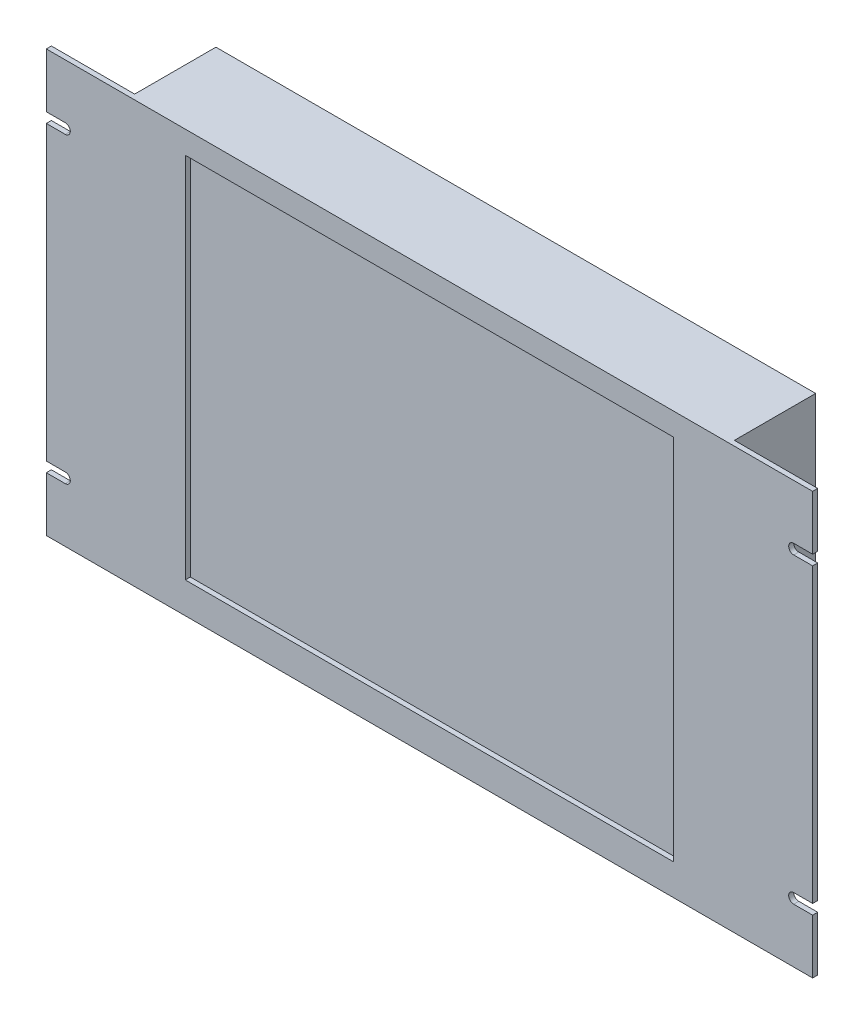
SolidWorks part; units mm, degrees
ref_plane "Front Plane" through (0, 0, 0) normal (0, 0, 1) x (1, 0, 0)
ref_plane "Top Plane" through (0, 0, 0) normal (0, 1, 0) x (1, 0, 0)
ref_plane "Right Plane" through (0, 0, 0) normal (1, 0, 0) x (0, 0, -1)
sketch "Sketch1" plane through (0, 0, 0) normal (0, 0, 1) x (1, 0, 0)
  line L32 (-241.3, 106.299) -> (-229.3874, 106.299)
  line L33 (-241.3, 106.299) -> (-241.3, -77.851)
  line L34 (-241.3, -77.851) -> (-229.3874, -77.851)
  line L35 (-241.3, -84.201) -> (-229.3874, -84.201)
  line L36 (-241.3, -118.491) -> (-241.3, -84.201)
  line L37 (241.3, -118.491) -> (-241.3, -118.491)
  line L38 (241.3, -118.491) -> (241.3, -84.201)
  line L39 (241.3, -84.201) -> (229.3874, -84.201)
  line L40 (241.3, -77.851) -> (229.3874, -77.851)
  line L41 (241.3, 106.299) -> (241.3, -77.851)
  line L42 (241.3, 106.299) -> (229.3874, 106.299)
  line L43 (241.3, 112.649) -> (229.3874, 112.649)
  line L44 (241.3, 112.649) -> (241.3, 146.939)
  line L45 (241.3, 146.939) -> (-241.3, 146.939)
  line L46 (-241.3, 112.649) -> (-241.3, 146.939)
  line L47 (-241.3, 112.649) -> (-229.3874, 112.649)
  line L48 (153.797, -98.933) -> (-153.797, -98.933)
  line L49 (-153.797, -98.933) -> (-153.797, 132.715)
  line L50 (-153.797, 132.715) -> (153.797, 132.715)
  line L51 (153.797, 132.715) -> (153.797, -98.933)
  arc A8 (-229.3874, -84.201) -> (-229.3874, -77.851) centre (-229.3874, -81.026) ccw
  arc A9 (229.3874, -77.851) -> (229.3874, -84.201) centre (229.3874, -81.026) ccw
  arc A10 (229.3874, 112.649) -> (229.3874, 106.299) centre (229.3874, 109.474) ccw
  arc A11 (-229.3874, 106.299) -> (-229.3874, 112.649) centre (-229.3874, 109.474) ccw
  point P28 (0, 0)
  point P29 (0, 0)
extrude "Boss-Extrude1" add sketch "Sketch1" along normal blind 3.175
sketch "Sketch2" plane through (0, 0, 0) normal (0, 0, -1) x (-1, 0, 0)
  line L0 (241.3, 177.165) -> (241.3, 143.256) construction
  line L3 (188.849, -118.491) -> (188.849, 146.939)
  line L4 (-188.849, -118.491) -> (-188.849, 146.939)
  line L5 (-188.849, -118.491) -> (188.849, -118.491)
  line L6 (-188.849, 146.939) -> (188.849, 146.939)
  line L7 (-153.797, -98.933) -> (153.797, -98.933) construction
  line L9 (-241.3, 146.939) -> (241.3, 146.939) construction
  line L10 (241.3, -118.491) -> (-241.3, -118.491) construction
  point P12 (0, 146.939)
  dimension "D1" = 377.698
extrude "Boss-Extrude2" add sketch "Sketch2" along normal blind 51.181
sketch "Sketch4" plane through (0, 0, -51.181) normal (0, 0, -1) x (-1, 0, 0)
  line L9 (106.7722, 119.1082) -> (106.7722, 131.8082)
  line L10 (104.2322, 131.8082) -> (104.2322, 119.1082)
  line L11 (106.7722, 131.8082) -> (104.2322, 131.8082)
  line L12 (106.7722, 119.1082) -> (104.2322, 119.1082)
  line L13 (113.1222, 119.1082) -> (113.1222, 131.8082)
  line L14 (110.5822, 131.8082) -> (110.5822, 119.1082)
  line L15 (113.1222, 131.8082) -> (110.5822, 131.8082)
  line L16 (113.1222, 119.1082) -> (110.5822, 119.1082)
  line L17 (119.4722, 119.1082) -> (119.4722, 131.8082)
  line L18 (116.9322, 131.8082) -> (116.9322, 119.1082)
  line L19 (119.4722, 131.8082) -> (116.9322, 131.8082)
  line L20 (119.4722, 119.1082) -> (116.9322, 119.1082)
  line L21 (125.8222, 119.1082) -> (125.8222, 131.8082)
  line L22 (123.2822, 131.8082) -> (123.2822, 119.1082)
  line L23 (125.8222, 131.8082) -> (123.2822, 131.8082)
  line L24 (125.8222, 119.1082) -> (123.2822, 119.1082)
  line L25 (132.1722, 119.1082) -> (132.1722, 131.8082)
  line L26 (129.6322, 131.8082) -> (129.6322, 119.1082)
  line L27 (132.1722, 131.8082) -> (129.6322, 131.8082)
  line L28 (132.1722, 119.1082) -> (129.6322, 119.1082)
  line L29 (138.5222, 119.1082) -> (138.5222, 131.8082)
  line L30 (135.9822, 131.8082) -> (135.9822, 119.1082)
  line L31 (138.5222, 131.8082) -> (135.9822, 131.8082)
  line L32 (138.5222, 119.1082) -> (135.9822, 119.1082)
  line L33 (144.8722, 119.1082) -> (144.8722, 131.8082)
  line L34 (142.3322, 131.8082) -> (142.3322, 119.1082)
  line L35 (144.8722, 131.8082) -> (142.3322, 131.8082)
  line L36 (144.8722, 119.1082) -> (142.3322, 119.1082)
  line L37 (151.2222, 119.1082) -> (151.2222, 131.8082)
  line L38 (148.6822, 131.8082) -> (148.6822, 119.1082)
  line L39 (151.2222, 131.8082) -> (148.6822, 131.8082)
  line L40 (151.2222, 119.1082) -> (148.6822, 119.1082)
  line L41 (157.5722, 119.1082) -> (157.5722, 131.8082)
  line L42 (155.0322, 131.8082) -> (155.0322, 119.1082)
  line L43 (157.5722, 131.8082) -> (155.0322, 131.8082)
  line L44 (157.5722, 119.1082) -> (155.0322, 119.1082)
  line L45 (163.9222, 119.1082) -> (163.9222, 131.8082)
  line L46 (161.3822, 131.8082) -> (161.3822, 119.1082)
  line L47 (163.9222, 131.8082) -> (161.3822, 131.8082)
  line L48 (163.9222, 119.1082) -> (161.3822, 119.1082)
  line L49 (70.222, 20.653) -> (70.222, 33.353)
  line L50 (67.682, 33.353) -> (67.682, 20.653)
  line L51 (70.222, 33.353) -> (67.682, 33.353)
  line L52 (70.222, 20.653) -> (67.682, 20.653)
  line L53 (76.572, 20.653) -> (76.572, 33.353)
  line L54 (74.032, 33.353) -> (74.032, 20.653)
  line L55 (76.572, 33.353) -> (74.032, 33.353)
  line L56 (76.572, 20.653) -> (74.032, 20.653)
  line L57 (70.222, 1.603) -> (70.222, 14.303)
  line L58 (67.682, 14.303) -> (67.682, 1.603)
  line L59 (70.222, 14.303) -> (67.682, 14.303)
  line L60 (70.222, 1.603) -> (67.682, 1.603)
  line L61 (76.572, 1.603) -> (76.572, 14.303)
  line L62 (74.032, 14.303) -> (74.032, 1.603)
  line L63 (76.572, 14.303) -> (74.032, 14.303)
  line L64 (76.572, 1.603) -> (74.032, 1.603)
  line L65 (82.922, 20.653) -> (82.922, 33.353)
  line L66 (80.382, 33.353) -> (80.382, 20.653)
  line L67 (82.922, 33.353) -> (80.382, 33.353)
  line L68 (82.922, 20.653) -> (80.382, 20.653)
  line L69 (89.272, 20.653) -> (89.272, 33.353)
  line L70 (86.732, 33.353) -> (86.732, 20.653)
  line L71 (89.272, 33.353) -> (86.732, 33.353)
  line L72 (89.272, 20.653) -> (86.732, 20.653)
  line L73 (95.622, 20.653) -> (95.622, 33.353)
  line L74 (93.082, 33.353) -> (93.082, 20.653)
  line L75 (95.622, 33.353) -> (93.082, 33.353)
  line L76 (95.622, 20.653) -> (93.082, 20.653)
  line L77 (101.972, 20.653) -> (101.972, 33.353)
  line L78 (99.432, 33.353) -> (99.432, 20.653)
  line L79 (101.972, 33.353) -> (99.432, 33.353)
  line L80 (101.972, 20.653) -> (99.432, 20.653)
  line L81 (82.922, 1.603) -> (82.922, 14.303)
  line L82 (80.382, 14.303) -> (80.382, 1.603)
  line L83 (82.922, 14.303) -> (80.382, 14.303)
  line L84 (82.922, 1.603) -> (80.382, 1.603)
  line L85 (89.272, 1.603) -> (89.272, 14.303)
  line L86 (86.732, 14.303) -> (86.732, 1.603)
  line L87 (89.272, 14.303) -> (86.732, 14.303)
  line L88 (89.272, 1.603) -> (86.732, 1.603)
  line L89 (95.622, 1.603) -> (95.622, 14.303)
  line L90 (93.082, 14.303) -> (93.082, 1.603)
  line L91 (95.622, 14.303) -> (93.082, 14.303)
  line L92 (95.622, 1.603) -> (93.082, 1.603)
  line L93 (101.972, 1.603) -> (101.972, 14.303)
  line L94 (99.432, 14.303) -> (99.432, 1.603)
  line L95 (101.972, 14.303) -> (99.432, 14.303)
  line L96 (101.972, 1.603) -> (99.432, 1.603)
  line L97 (108.322, 20.653) -> (108.322, 33.353)
  line L98 (105.782, 33.353) -> (105.782, 20.653)
  line L99 (108.322, 33.353) -> (105.782, 33.353)
  line L100 (108.322, 20.653) -> (105.782, 20.653)
  line L101 (114.672, 20.653) -> (114.672, 33.353)
  line L102 (112.132, 33.353) -> (112.132, 20.653)
  line L103 (114.672, 33.353) -> (112.132, 33.353)
  line L104 (114.672, 20.653) -> (112.132, 20.653)
  line L105 (121.022, 20.653) -> (121.022, 33.353)
  line L106 (118.482, 33.353) -> (118.482, 20.653)
  line L107 (121.022, 33.353) -> (118.482, 33.353)
  line L108 (121.022, 20.653) -> (118.482, 20.653)
  line L109 (108.322, 1.603) -> (108.322, 14.303)
  line L110 (105.782, 14.303) -> (105.782, 1.603)
  line L111 (108.322, 14.303) -> (105.782, 14.303)
  line L112 (108.322, 1.603) -> (105.782, 1.603)
  line L113 (114.672, 1.603) -> (114.672, 14.303)
  line L114 (112.132, 14.303) -> (112.132, 1.603)
  line L115 (114.672, 14.303) -> (112.132, 14.303)
  line L116 (114.672, 1.603) -> (112.132, 1.603)
  line L117 (121.022, 1.603) -> (121.022, 14.303)
  line L118 (118.482, 14.303) -> (118.482, 1.603)
  line L119 (121.022, 14.303) -> (118.482, 14.303)
  line L120 (121.022, 1.603) -> (118.482, 1.603)
  line L121 (-105.3114, 119.1082) -> (-105.3114, 131.8082)
  line L122 (-102.7714, 131.8082) -> (-102.7714, 119.1082)
  line L123 (-105.3114, 131.8082) -> (-102.7714, 131.8082)
  line L124 (-105.3114, 119.1082) -> (-102.7714, 119.1082)
  line L125 (-111.6614, 119.1082) -> (-111.6614, 131.8082)
  line L126 (-109.1214, 131.8082) -> (-109.1214, 119.1082)
  line L127 (-111.6614, 131.8082) -> (-109.1214, 131.8082)
  line L128 (-111.6614, 119.1082) -> (-109.1214, 119.1082)
  line L129 (-118.0114, 119.1082) -> (-118.0114, 131.8082)
  line L130 (-115.4714, 131.8082) -> (-115.4714, 119.1082)
  line L131 (-118.0114, 131.8082) -> (-115.4714, 131.8082)
  line L132 (-118.0114, 119.1082) -> (-115.4714, 119.1082)
  line L133 (-105.3114, 100.0582) -> (-105.3114, 112.7582)
  line L134 (-102.7714, 112.7582) -> (-102.7714, 100.0582)
  line L135 (-105.3114, 112.7582) -> (-102.7714, 112.7582)
  line L136 (-105.3114, 100.0582) -> (-102.7714, 100.0582)
  line L137 (-111.6614, 100.0582) -> (-111.6614, 112.7582)
  line L138 (-109.1214, 112.7582) -> (-109.1214, 100.0582)
  line L139 (-111.6614, 112.7582) -> (-109.1214, 112.7582)
  line L140 (-111.6614, 100.0582) -> (-109.1214, 100.0582)
  line L141 (-118.0114, 100.0582) -> (-118.0114, 112.7582)
  line L142 (-115.4714, 112.7582) -> (-115.4714, 100.0582)
  line L143 (-118.0114, 112.7582) -> (-115.4714, 112.7582)
  line L144 (-118.0114, 100.0582) -> (-115.4714, 100.0582)
  line L145 (-124.3614, 119.1082) -> (-124.3614, 131.8082)
  line L146 (-121.8214, 131.8082) -> (-121.8214, 119.1082)
  line L147 (-124.3614, 131.8082) -> (-121.8214, 131.8082)
  line L148 (-124.3614, 119.1082) -> (-121.8214, 119.1082)
  line L149 (-124.3614, 100.0582) -> (-124.3614, 112.7582)
  line L150 (-121.8214, 112.7582) -> (-121.8214, 100.0582)
  line L151 (-124.3614, 112.7582) -> (-121.8214, 112.7582)
  line L152 (-124.3614, 100.0582) -> (-121.8214, 100.0582)
  line L153 (-130.7114, 119.1082) -> (-130.7114, 131.8082)
  line L154 (-128.1714, 131.8082) -> (-128.1714, 119.1082)
  line L155 (-130.7114, 131.8082) -> (-128.1714, 131.8082)
  line L156 (-130.7114, 119.1082) -> (-128.1714, 119.1082)
  line L157 (-130.7114, 100.0582) -> (-130.7114, 112.7582)
  line L158 (-128.1714, 112.7582) -> (-128.1714, 100.0582)
  line L159 (-130.7114, 112.7582) -> (-128.1714, 112.7582)
  line L160 (-130.7114, 100.0582) -> (-128.1714, 100.0582)
  line L161 (-137.0614, 119.1082) -> (-137.0614, 131.8082)
  line L162 (-134.5214, 131.8082) -> (-134.5214, 119.1082)
  line L163 (-137.0614, 131.8082) -> (-134.5214, 131.8082)
  line L164 (-137.0614, 119.1082) -> (-134.5214, 119.1082)
  line L165 (-137.0614, 100.0582) -> (-137.0614, 112.7582)
  line L166 (-134.5214, 112.7582) -> (-134.5214, 100.0582)
  line L167 (-137.0614, 112.7582) -> (-134.5214, 112.7582)
  line L168 (-137.0614, 100.0582) -> (-134.5214, 100.0582)
  line L169 (-143.4114, 119.1082) -> (-143.4114, 131.8082)
  line L170 (-140.8714, 131.8082) -> (-140.8714, 119.1082)
  line L171 (-143.4114, 131.8082) -> (-140.8714, 131.8082)
  line L172 (-143.4114, 119.1082) -> (-140.8714, 119.1082)
  line L173 (-143.4114, 100.0582) -> (-143.4114, 112.7582)
  line L174 (-140.8714, 112.7582) -> (-140.8714, 100.0582)
  line L175 (-143.4114, 112.7582) -> (-140.8714, 112.7582)
  line L176 (-143.4114, 100.0582) -> (-140.8714, 100.0582)
  line L177 (-149.7614, 119.1082) -> (-149.7614, 131.8082)
  line L178 (-147.2214, 131.8082) -> (-147.2214, 119.1082)
  line L179 (-149.7614, 131.8082) -> (-147.2214, 131.8082)
  line L180 (-149.7614, 119.1082) -> (-147.2214, 119.1082)
  line L181 (-149.7614, 100.0582) -> (-149.7614, 112.7582)
  line L182 (-147.2214, 112.7582) -> (-147.2214, 100.0582)
  line L183 (-149.7614, 112.7582) -> (-147.2214, 112.7582)
  line L184 (-149.7614, 100.0582) -> (-147.2214, 100.0582)
  line L185 (-156.1114, 119.1082) -> (-156.1114, 131.8082)
  line L186 (-153.5714, 131.8082) -> (-153.5714, 119.1082)
  line L187 (-156.1114, 131.8082) -> (-153.5714, 131.8082)
  line L188 (-156.1114, 119.1082) -> (-153.5714, 119.1082)
  line L189 (-156.1114, 100.0582) -> (-156.1114, 112.7582)
  line L190 (-153.5714, 112.7582) -> (-153.5714, 100.0582)
  line L191 (-156.1114, 112.7582) -> (-153.5714, 112.7582)
  line L192 (-156.1114, 100.0582) -> (-153.5714, 100.0582)
  line L193 (-162.4614, 119.1082) -> (-162.4614, 131.8082)
  line L194 (-159.9214, 131.8082) -> (-159.9214, 119.1082)
  line L195 (-162.4614, 131.8082) -> (-159.9214, 131.8082)
  line L196 (-162.4614, 119.1082) -> (-159.9214, 119.1082)
  line L197 (-162.4614, 100.0582) -> (-162.4614, 112.7582)
  line L198 (-159.9214, 112.7582) -> (-159.9214, 100.0582)
  line L199 (-162.4614, 112.7582) -> (-159.9214, 112.7582)
  line L200 (-162.4614, 100.0582) -> (-159.9214, 100.0582)
  line L201 (-79.9114, 119.1082) -> (-79.9114, 131.8082)
  line L202 (-77.3714, 131.8082) -> (-77.3714, 119.1082)
  line L203 (-79.9114, 131.8082) -> (-77.3714, 131.8082)
  line L204 (-79.9114, 119.1082) -> (-77.3714, 119.1082)
  line L205 (-86.2614, 119.1082) -> (-86.2614, 131.8082)
  line L206 (-83.7214, 131.8082) -> (-83.7214, 119.1082)
  line L207 (-86.2614, 131.8082) -> (-83.7214, 131.8082)
  line L208 (-86.2614, 119.1082) -> (-83.7214, 119.1082)
  line L209 (-92.6114, 119.1082) -> (-92.6114, 131.8082)
  line L210 (-90.0714, 131.8082) -> (-90.0714, 119.1082)
  line L211 (-92.6114, 131.8082) -> (-90.0714, 131.8082)
  line L212 (-92.6114, 119.1082) -> (-90.0714, 119.1082)
  line L213 (-79.9114, 100.0582) -> (-79.9114, 112.7582)
  line L214 (-77.3714, 112.7582) -> (-77.3714, 100.0582)
  line L215 (-79.9114, 112.7582) -> (-77.3714, 112.7582)
  line L216 (-79.9114, 100.0582) -> (-77.3714, 100.0582)
  line L217 (-86.2614, 100.0582) -> (-86.2614, 112.7582)
  line L218 (-83.7214, 112.7582) -> (-83.7214, 100.0582)
  line L219 (-86.2614, 112.7582) -> (-83.7214, 112.7582)
  line L220 (-86.2614, 100.0582) -> (-83.7214, 100.0582)
  line L221 (-92.6114, 100.0582) -> (-92.6114, 112.7582)
  line L222 (-90.0714, 112.7582) -> (-90.0714, 100.0582)
  line L223 (-92.6114, 112.7582) -> (-90.0714, 112.7582)
  line L224 (-92.6114, 100.0582) -> (-90.0714, 100.0582)
  line L225 (-98.9614, 119.1082) -> (-98.9614, 131.8082)
  line L226 (-96.4214, 131.8082) -> (-96.4214, 119.1082)
  line L227 (-98.9614, 131.8082) -> (-96.4214, 131.8082)
  line L228 (-98.9614, 119.1082) -> (-96.4214, 119.1082)
  line L229 (-98.9614, 100.0582) -> (-98.9614, 112.7582)
  line L230 (-96.4214, 112.7582) -> (-96.4214, 100.0582)
  line L231 (-98.9614, 112.7582) -> (-96.4214, 112.7582)
  line L232 (-98.9614, 100.0582) -> (-96.4214, 100.0582)
  line L233 (81.3722, 119.1082) -> (81.3722, 131.8082)
  line L234 (78.8322, 131.8082) -> (78.8322, 119.1082)
  line L235 (81.3722, 131.8082) -> (78.8322, 131.8082)
  line L236 (81.3722, 119.1082) -> (78.8322, 119.1082)
  line L237 (87.7222, 119.1082) -> (87.7222, 131.8082)
  line L238 (85.1822, 131.8082) -> (85.1822, 119.1082)
  line L239 (87.7222, 131.8082) -> (85.1822, 131.8082)
  line L240 (87.7222, 119.1082) -> (85.1822, 119.1082)
  line L241 (94.0722, 119.1082) -> (94.0722, 131.8082)
  line L242 (91.5322, 131.8082) -> (91.5322, 119.1082)
  line L243 (94.0722, 131.8082) -> (91.5322, 131.8082)
  line L244 (94.0722, 119.1082) -> (91.5322, 119.1082)
  line L245 (100.4222, 119.1082) -> (100.4222, 131.8082)
  line L246 (97.8822, 131.8082) -> (97.8822, 119.1082)
  line L247 (100.4222, 131.8082) -> (97.8822, 131.8082)
  line L248 (100.4222, 119.1082) -> (97.8822, 119.1082)
  line L249 (-54.5114, 119.1082) -> (-54.5114, 131.8082)
  line L250 (-51.9714, 131.8082) -> (-51.9714, 119.1082)
  line L251 (-54.5114, 131.8082) -> (-51.9714, 131.8082)
  line L252 (-54.5114, 119.1082) -> (-51.9714, 119.1082)
  line L253 (-60.8614, 119.1082) -> (-60.8614, 131.8082)
  line L254 (-58.3214, 131.8082) -> (-58.3214, 119.1082)
  line L255 (-60.8614, 131.8082) -> (-58.3214, 131.8082)
  line L256 (-60.8614, 119.1082) -> (-58.3214, 119.1082)
  line L257 (-67.2114, 119.1082) -> (-67.2114, 131.8082)
  line L258 (-64.6714, 131.8082) -> (-64.6714, 119.1082)
  line L259 (-67.2114, 131.8082) -> (-64.6714, 131.8082)
  line L260 (-67.2114, 119.1082) -> (-64.6714, 119.1082)
  line L261 (-73.5614, 119.1082) -> (-73.5614, 131.8082)
  line L262 (-71.0214, 131.8082) -> (-71.0214, 119.1082)
  line L263 (-73.5614, 131.8082) -> (-71.0214, 131.8082)
  line L264 (-73.5614, 119.1082) -> (-71.0214, 119.1082)
  line L265 (-29.1114, 119.1082) -> (-29.1114, 131.8082)
  line L266 (-26.5714, 131.8082) -> (-26.5714, 119.1082)
  line L267 (-29.1114, 131.8082) -> (-26.5714, 131.8082)
  line L268 (-29.1114, 119.1082) -> (-26.5714, 119.1082)
  line L269 (-35.4614, 119.1082) -> (-35.4614, 131.8082)
  line L270 (-32.9214, 131.8082) -> (-32.9214, 119.1082)
  line L271 (-35.4614, 131.8082) -> (-32.9214, 131.8082)
  line L272 (-35.4614, 119.1082) -> (-32.9214, 119.1082)
  line L273 (-41.8114, 119.1082) -> (-41.8114, 131.8082)
  line L274 (-39.2714, 131.8082) -> (-39.2714, 119.1082)
  line L275 (-41.8114, 131.8082) -> (-39.2714, 131.8082)
  line L276 (-41.8114, 119.1082) -> (-39.2714, 119.1082)
  line L277 (-48.1614, 119.1082) -> (-48.1614, 131.8082)
  line L278 (-45.6214, 131.8082) -> (-45.6214, 119.1082)
  line L279 (-48.1614, 131.8082) -> (-45.6214, 131.8082)
  line L280 (-48.1614, 119.1082) -> (-45.6214, 119.1082)
  line L281 (-3.7114, 119.1082) -> (-3.7114, 131.8082)
  line L282 (-1.1714, 131.8082) -> (-1.1714, 119.1082)
  line L283 (-3.7114, 131.8082) -> (-1.1714, 131.8082)
  line L284 (-3.7114, 119.1082) -> (-1.1714, 119.1082)
  line L285 (-10.0614, 119.1082) -> (-10.0614, 131.8082)
  line L286 (-7.5214, 131.8082) -> (-7.5214, 119.1082)
  line L287 (-10.0614, 131.8082) -> (-7.5214, 131.8082)
  line L288 (-10.0614, 119.1082) -> (-7.5214, 119.1082)
  line L289 (-16.4114, 119.1082) -> (-16.4114, 131.8082)
  line L290 (-13.8714, 131.8082) -> (-13.8714, 119.1082)
  line L291 (-16.4114, 131.8082) -> (-13.8714, 131.8082)
  line L292 (-16.4114, 119.1082) -> (-13.8714, 119.1082)
  line L293 (-22.7614, 119.1082) -> (-22.7614, 131.8082)
  line L294 (-20.2214, 131.8082) -> (-20.2214, 119.1082)
  line L295 (-22.7614, 131.8082) -> (-20.2214, 131.8082)
  line L296 (-22.7614, 119.1082) -> (-20.2214, 119.1082)
  line L297 (21.6886, 119.1082) -> (21.6886, 131.8082)
  line L298 (24.2286, 131.8082) -> (24.2286, 119.1082)
  line L299 (21.6886, 131.8082) -> (24.2286, 131.8082)
  line L300 (21.6886, 119.1082) -> (24.2286, 119.1082)
  line L301 (15.3386, 119.1082) -> (15.3386, 131.8082)
  line L302 (17.8786, 131.8082) -> (17.8786, 119.1082)
  line L303 (15.3386, 131.8082) -> (17.8786, 131.8082)
  line L304 (15.3386, 119.1082) -> (17.8786, 119.1082)
  line L305 (8.9886, 119.1082) -> (8.9886, 131.8082)
  line L306 (11.5286, 131.8082) -> (11.5286, 119.1082)
  line L307 (8.9886, 131.8082) -> (11.5286, 131.8082)
  line L308 (8.9886, 119.1082) -> (11.5286, 119.1082)
  line L309 (2.6386, 119.1082) -> (2.6386, 131.8082)
  line L310 (5.1786, 131.8082) -> (5.1786, 119.1082)
  line L311 (2.6386, 131.8082) -> (5.1786, 131.8082)
  line L312 (2.6386, 119.1082) -> (5.1786, 119.1082)
  line L313 (47.0886, 119.1082) -> (47.0886, 131.8082)
  line L314 (49.6286, 131.8082) -> (49.6286, 119.1082)
  line L315 (47.0886, 131.8082) -> (49.6286, 131.8082)
  line L316 (47.0886, 119.1082) -> (49.6286, 119.1082)
  line L317 (40.7386, 119.1082) -> (40.7386, 131.8082)
  line L318 (43.2786, 131.8082) -> (43.2786, 119.1082)
  line L319 (40.7386, 131.8082) -> (43.2786, 131.8082)
  line L320 (40.7386, 119.1082) -> (43.2786, 119.1082)
  line L321 (34.3886, 119.1082) -> (34.3886, 131.8082)
  line L322 (36.9286, 131.8082) -> (36.9286, 119.1082)
  line L323 (34.3886, 131.8082) -> (36.9286, 131.8082)
  line L324 (34.3886, 119.1082) -> (36.9286, 119.1082)
  line L325 (28.0386, 119.1082) -> (28.0386, 131.8082)
  line L326 (30.5786, 131.8082) -> (30.5786, 119.1082)
  line L327 (28.0386, 131.8082) -> (30.5786, 131.8082)
  line L328 (28.0386, 119.1082) -> (30.5786, 119.1082)
  line L329 (72.4886, 119.1082) -> (72.4886, 131.8082)
  line L330 (75.0286, 131.8082) -> (75.0286, 119.1082)
  line L331 (72.4886, 131.8082) -> (75.0286, 131.8082)
  line L332 (72.4886, 119.1082) -> (75.0286, 119.1082)
  line L333 (66.1386, 119.1082) -> (66.1386, 131.8082)
  line L334 (68.6786, 131.8082) -> (68.6786, 119.1082)
  line L335 (66.1386, 131.8082) -> (68.6786, 131.8082)
  line L336 (66.1386, 119.1082) -> (68.6786, 119.1082)
  line L337 (59.7886, 119.1082) -> (59.7886, 131.8082)
  line L338 (62.3286, 131.8082) -> (62.3286, 119.1082)
  line L339 (59.7886, 131.8082) -> (62.3286, 131.8082)
  line L340 (59.7886, 119.1082) -> (62.3286, 119.1082)
  line L341 (53.4386, 119.1082) -> (53.4386, 131.8082)
  line L342 (55.9786, 131.8082) -> (55.9786, 119.1082)
  line L343 (53.4386, 131.8082) -> (55.9786, 131.8082)
  line L344 (53.4386, 119.1082) -> (55.9786, 119.1082)
  line L345 (70.222, -17.447) -> (70.222, -4.747)
  line L346 (67.682, -4.747) -> (67.682, -17.447)
  line L347 (70.222, -4.747) -> (67.682, -4.747)
  line L348 (70.222, -17.447) -> (67.682, -17.447)
  line L349 (76.572, -17.447) -> (76.572, -4.747)
  line L350 (74.032, -4.747) -> (74.032, -17.447)
  line L351 (76.572, -4.747) -> (74.032, -4.747)
  line L352 (76.572, -17.447) -> (74.032, -17.447)
  line L353 (82.922, -17.447) -> (82.922, -4.747)
  line L354 (80.382, -4.747) -> (80.382, -17.447)
  line L355 (82.922, -4.747) -> (80.382, -4.747)
  line L356 (82.922, -17.447) -> (80.382, -17.447)
  line L357 (89.272, -17.447) -> (89.272, -4.747)
  line L358 (86.732, -4.747) -> (86.732, -17.447)
  line L359 (89.272, -4.747) -> (86.732, -4.747)
  line L360 (89.272, -17.447) -> (86.732, -17.447)
  line L361 (95.622, -17.447) -> (95.622, -4.747)
  line L362 (93.082, -4.747) -> (93.082, -17.447)
  line L363 (95.622, -4.747) -> (93.082, -4.747)
  line L364 (95.622, -17.447) -> (93.082, -17.447)
  line L365 (101.972, -17.447) -> (101.972, -4.747)
  line L366 (99.432, -4.747) -> (99.432, -17.447)
  line L367 (101.972, -4.747) -> (99.432, -4.747)
  line L368 (101.972, -17.447) -> (99.432, -17.447)
  line L369 (108.322, -17.447) -> (108.322, -4.747)
  line L370 (105.782, -4.747) -> (105.782, -17.447)
  line L371 (108.322, -4.747) -> (105.782, -4.747)
  line L372 (108.322, -17.447) -> (105.782, -17.447)
  line L373 (114.672, -17.447) -> (114.672, -4.747)
  line L374 (112.132, -4.747) -> (112.132, -17.447)
  line L375 (114.672, -4.747) -> (112.132, -4.747)
  line L376 (114.672, -17.447) -> (112.132, -17.447)
  line L377 (121.022, -17.447) -> (121.022, -4.747)
  line L378 (118.482, -4.747) -> (118.482, -17.447)
  line L379 (121.022, -4.747) -> (118.482, -4.747)
  line L380 (121.022, -17.447) -> (118.482, -17.447)
  line L381 (-105.3114, 81.0082) -> (-105.3114, 93.7082)
  line L382 (-102.7714, 93.7082) -> (-102.7714, 81.0082)
  line L383 (-105.3114, 93.7082) -> (-102.7714, 93.7082)
  line L384 (-105.3114, 81.0082) -> (-102.7714, 81.0082)
  line L385 (-111.6614, 81.0082) -> (-111.6614, 93.7082)
  line L386 (-109.1214, 93.7082) -> (-109.1214, 81.0082)
  line L387 (-111.6614, 93.7082) -> (-109.1214, 93.7082)
  line L388 (-111.6614, 81.0082) -> (-109.1214, 81.0082)
  line L389 (-118.0114, 81.0082) -> (-118.0114, 93.7082)
  line L390 (-115.4714, 93.7082) -> (-115.4714, 81.0082)
  line L391 (-118.0114, 93.7082) -> (-115.4714, 93.7082)
  line L392 (-118.0114, 81.0082) -> (-115.4714, 81.0082)
  line L393 (-124.3614, 81.0082) -> (-124.3614, 93.7082)
  line L394 (-121.8214, 93.7082) -> (-121.8214, 81.0082)
  line L395 (-124.3614, 93.7082) -> (-121.8214, 93.7082)
  line L396 (-124.3614, 81.0082) -> (-121.8214, 81.0082)
  line L397 (-130.7114, 81.0082) -> (-130.7114, 93.7082)
  line L398 (-128.1714, 93.7082) -> (-128.1714, 81.0082)
  line L399 (-130.7114, 93.7082) -> (-128.1714, 93.7082)
  line L400 (-130.7114, 81.0082) -> (-128.1714, 81.0082)
  line L401 (-137.0614, 81.0082) -> (-137.0614, 93.7082)
  line L402 (-134.5214, 93.7082) -> (-134.5214, 81.0082)
  line L403 (-137.0614, 93.7082) -> (-134.5214, 93.7082)
  line L404 (-137.0614, 81.0082) -> (-134.5214, 81.0082)
  line L405 (-143.4114, 81.0082) -> (-143.4114, 93.7082)
  line L406 (-140.8714, 93.7082) -> (-140.8714, 81.0082)
  line L407 (-143.4114, 93.7082) -> (-140.8714, 93.7082)
  line L408 (-143.4114, 81.0082) -> (-140.8714, 81.0082)
  line L409 (-105.3114, 61.9582) -> (-105.3114, 74.6582)
  line L410 (-102.7714, 74.6582) -> (-102.7714, 61.9582)
  line L411 (-105.3114, 74.6582) -> (-102.7714, 74.6582)
  line L412 (-105.3114, 61.9582) -> (-102.7714, 61.9582)
  line L413 (-111.6614, 61.9582) -> (-111.6614, 74.6582)
  line L414 (-109.1214, 74.6582) -> (-109.1214, 61.9582)
  line L415 (-111.6614, 74.6582) -> (-109.1214, 74.6582)
  line L416 (-111.6614, 61.9582) -> (-109.1214, 61.9582)
  line L417 (-118.0114, 61.9582) -> (-118.0114, 74.6582)
  line L418 (-115.4714, 74.6582) -> (-115.4714, 61.9582)
  line L419 (-118.0114, 74.6582) -> (-115.4714, 74.6582)
  line L420 (-118.0114, 61.9582) -> (-115.4714, 61.9582)
  line L421 (-124.3614, 61.9582) -> (-124.3614, 74.6582)
  line L422 (-121.8214, 74.6582) -> (-121.8214, 61.9582)
  line L423 (-124.3614, 74.6582) -> (-121.8214, 74.6582)
  line L424 (-124.3614, 61.9582) -> (-121.8214, 61.9582)
  line L425 (-130.7114, 61.9582) -> (-130.7114, 74.6582)
  line L426 (-128.1714, 74.6582) -> (-128.1714, 61.9582)
  line L427 (-130.7114, 74.6582) -> (-128.1714, 74.6582)
  line L428 (-130.7114, 61.9582) -> (-128.1714, 61.9582)
  line L429 (-137.0614, 61.9582) -> (-137.0614, 74.6582)
  line L430 (-134.5214, 74.6582) -> (-134.5214, 61.9582)
  line L431 (-137.0614, 74.6582) -> (-134.5214, 74.6582)
  line L432 (-137.0614, 61.9582) -> (-134.5214, 61.9582)
  line L433 (-143.4114, 61.9582) -> (-143.4114, 74.6582)
  line L434 (-140.8714, 74.6582) -> (-140.8714, 61.9582)
  line L435 (-143.4114, 74.6582) -> (-140.8714, 74.6582)
  line L436 (-143.4114, 61.9582) -> (-140.8714, 61.9582)
  line L437 (-149.7614, 61.9582) -> (-149.7614, 74.6582)
  line L438 (-147.2214, 74.6582) -> (-147.2214, 61.9582)
  line L439 (-149.7614, 74.6582) -> (-147.2214, 74.6582)
  line L440 (-149.7614, 61.9582) -> (-147.2214, 61.9582)
  line L441 (-156.1114, 61.9582) -> (-156.1114, 74.6582)
  line L442 (-153.5714, 74.6582) -> (-153.5714, 61.9582)
  line L443 (-156.1114, 74.6582) -> (-153.5714, 74.6582)
  line L444 (-156.1114, 61.9582) -> (-153.5714, 61.9582)
  line L445 (-105.3114, 42.9082) -> (-105.3114, 55.6082)
  line L446 (-102.7714, 55.6082) -> (-102.7714, 42.9082)
  line L447 (-105.3114, 55.6082) -> (-102.7714, 55.6082)
  line L448 (-105.3114, 42.9082) -> (-102.7714, 42.9082)
  line L449 (-111.6614, 42.9082) -> (-111.6614, 55.6082)
  line L450 (-109.1214, 55.6082) -> (-109.1214, 42.9082)
  line L451 (-111.6614, 55.6082) -> (-109.1214, 55.6082)
  line L452 (-111.6614, 42.9082) -> (-109.1214, 42.9082)
  line L453 (-118.0114, 42.9082) -> (-118.0114, 55.6082)
  line L454 (-115.4714, 55.6082) -> (-115.4714, 42.9082)
  line L455 (-118.0114, 55.6082) -> (-115.4714, 55.6082)
  line L456 (-118.0114, 42.9082) -> (-115.4714, 42.9082)
  line L457 (-124.3614, 42.9082) -> (-124.3614, 55.6082)
  line L458 (-121.8214, 55.6082) -> (-121.8214, 42.9082)
  line L459 (-124.3614, 55.6082) -> (-121.8214, 55.6082)
  line L460 (-124.3614, 42.9082) -> (-121.8214, 42.9082)
  line L461 (-130.7114, 42.9082) -> (-130.7114, 55.6082)
  line L462 (-128.1714, 55.6082) -> (-128.1714, 42.9082)
  line L463 (-130.7114, 55.6082) -> (-128.1714, 55.6082)
  line L464 (-130.7114, 42.9082) -> (-128.1714, 42.9082)
  line L465 (-137.0614, 42.9082) -> (-137.0614, 55.6082)
  line L466 (-134.5214, 55.6082) -> (-134.5214, 42.9082)
  line L467 (-137.0614, 55.6082) -> (-134.5214, 55.6082)
  line L468 (-137.0614, 42.9082) -> (-134.5214, 42.9082)
  line L469 (-143.4114, 42.9082) -> (-143.4114, 55.6082)
  line L470 (-140.8714, 55.6082) -> (-140.8714, 42.9082)
  line L471 (-143.4114, 55.6082) -> (-140.8714, 55.6082)
  line L472 (-143.4114, 42.9082) -> (-140.8714, 42.9082)
  line L473 (-149.7614, 42.9082) -> (-149.7614, 55.6082)
  line L474 (-147.2214, 55.6082) -> (-147.2214, 42.9082)
  line L475 (-149.7614, 55.6082) -> (-147.2214, 55.6082)
  line L476 (-149.7614, 42.9082) -> (-147.2214, 42.9082)
  line L477 (-156.1114, 42.9082) -> (-156.1114, 55.6082)
  line L478 (-153.5714, 55.6082) -> (-153.5714, 42.9082)
  line L479 (-156.1114, 55.6082) -> (-153.5714, 55.6082)
  line L480 (-156.1114, 42.9082) -> (-153.5714, 42.9082)
  line L481 (-162.4614, 42.9082) -> (-162.4614, 55.6082)
  line L482 (-159.9214, 55.6082) -> (-159.9214, 42.9082)
  line L483 (-162.4614, 55.6082) -> (-159.9214, 55.6082)
  line L484 (-162.4614, 42.9082) -> (-159.9214, 42.9082)
  line L485 (-105.3114, 23.8582) -> (-105.3114, 36.5582)
  line L486 (-102.7714, 36.5582) -> (-102.7714, 23.8582)
  line L487 (-105.3114, 36.5582) -> (-102.7714, 36.5582)
  line L488 (-105.3114, 23.8582) -> (-102.7714, 23.8582)
  line L489 (-111.6614, 23.8582) -> (-111.6614, 36.5582)
  line L490 (-109.1214, 36.5582) -> (-109.1214, 23.8582)
  line L491 (-111.6614, 36.5582) -> (-109.1214, 36.5582)
  line L492 (-111.6614, 23.8582) -> (-109.1214, 23.8582)
  line L493 (-118.0114, 23.8582) -> (-118.0114, 36.5582)
  line L494 (-115.4714, 36.5582) -> (-115.4714, 23.8582)
  line L495 (-118.0114, 36.5582) -> (-115.4714, 36.5582)
  line L496 (-118.0114, 23.8582) -> (-115.4714, 23.8582)
  line L497 (-124.3614, 23.8582) -> (-124.3614, 36.5582)
  line L498 (-121.8214, 36.5582) -> (-121.8214, 23.8582)
  line L499 (-124.3614, 36.5582) -> (-121.8214, 36.5582)
  line L500 (-124.3614, 23.8582) -> (-121.8214, 23.8582)
  line L501 (-130.7114, 23.8582) -> (-130.7114, 36.5582)
  line L502 (-128.1714, 36.5582) -> (-128.1714, 23.8582)
  line L503 (-130.7114, 36.5582) -> (-128.1714, 36.5582)
  line L504 (-130.7114, 23.8582) -> (-128.1714, 23.8582)
  line L505 (-137.0614, 23.8582) -> (-137.0614, 36.5582)
  line L506 (-134.5214, 36.5582) -> (-134.5214, 23.8582)
  line L507 (-137.0614, 36.5582) -> (-134.5214, 36.5582)
  line L508 (-137.0614, 23.8582) -> (-134.5214, 23.8582)
  line L509 (-143.4114, 23.8582) -> (-143.4114, 36.5582)
  line L510 (-140.8714, 36.5582) -> (-140.8714, 23.8582)
  line L511 (-143.4114, 36.5582) -> (-140.8714, 36.5582)
  line L512 (-143.4114, 23.8582) -> (-140.8714, 23.8582)
  line L513 (-149.7614, 23.8582) -> (-149.7614, 36.5582)
  line L514 (-147.2214, 36.5582) -> (-147.2214, 23.8582)
  line L515 (-149.7614, 36.5582) -> (-147.2214, 36.5582)
  line L516 (-149.7614, 23.8582) -> (-147.2214, 23.8582)
  line L517 (-156.1114, 23.8582) -> (-156.1114, 36.5582)
  line L518 (-153.5714, 36.5582) -> (-153.5714, 23.8582)
  line L519 (-156.1114, 36.5582) -> (-153.5714, 36.5582)
  line L520 (-156.1114, 23.8582) -> (-153.5714, 23.8582)
  line L521 (-162.4614, 23.8582) -> (-162.4614, 36.5582)
  line L522 (-159.9214, 36.5582) -> (-159.9214, 23.8582)
  line L523 (-162.4614, 36.5582) -> (-159.9214, 36.5582)
  line L524 (-162.4614, 23.8582) -> (-159.9214, 23.8582)
  line L525 (-105.3114, 4.8082) -> (-105.3114, 17.5082)
  line L526 (-102.7714, 17.5082) -> (-102.7714, 4.8082)
  line L527 (-105.3114, 17.5082) -> (-102.7714, 17.5082)
  line L528 (-105.3114, 4.8082) -> (-102.7714, 4.8082)
  line L529 (-111.6614, 4.8082) -> (-111.6614, 17.5082)
  line L530 (-109.1214, 17.5082) -> (-109.1214, 4.8082)
  line L531 (-111.6614, 17.5082) -> (-109.1214, 17.5082)
  line L532 (-111.6614, 4.8082) -> (-109.1214, 4.8082)
  line L533 (-118.0114, 4.8082) -> (-118.0114, 17.5082)
  line L534 (-115.4714, 17.5082) -> (-115.4714, 4.8082)
  line L535 (-118.0114, 17.5082) -> (-115.4714, 17.5082)
  line L536 (-118.0114, 4.8082) -> (-115.4714, 4.8082)
  line L537 (-124.3614, 4.8082) -> (-124.3614, 17.5082)
  line L538 (-121.8214, 17.5082) -> (-121.8214, 4.8082)
  line L539 (-124.3614, 17.5082) -> (-121.8214, 17.5082)
  line L540 (-124.3614, 4.8082) -> (-121.8214, 4.8082)
  line L541 (-130.7114, 4.8082) -> (-130.7114, 17.5082)
  line L542 (-128.1714, 17.5082) -> (-128.1714, 4.8082)
  line L543 (-130.7114, 17.5082) -> (-128.1714, 17.5082)
  line L544 (-130.7114, 4.8082) -> (-128.1714, 4.8082)
  line L545 (-137.0614, 4.8082) -> (-137.0614, 17.5082)
  line L546 (-134.5214, 17.5082) -> (-134.5214, 4.8082)
  line L547 (-137.0614, 17.5082) -> (-134.5214, 17.5082)
  line L548 (-137.0614, 4.8082) -> (-134.5214, 4.8082)
  line L549 (-143.4114, 4.8082) -> (-143.4114, 17.5082)
  line L550 (-140.8714, 17.5082) -> (-140.8714, 4.8082)
  line L551 (-143.4114, 17.5082) -> (-140.8714, 17.5082)
  line L552 (-143.4114, 4.8082) -> (-140.8714, 4.8082)
  line L553 (-149.7614, 4.8082) -> (-149.7614, 17.5082)
  line L554 (-147.2214, 17.5082) -> (-147.2214, 4.8082)
  line L555 (-149.7614, 17.5082) -> (-147.2214, 17.5082)
  line L556 (-149.7614, 4.8082) -> (-147.2214, 4.8082)
  line L557 (-156.1114, 4.8082) -> (-156.1114, 17.5082)
  line L558 (-153.5714, 17.5082) -> (-153.5714, 4.8082)
  line L559 (-156.1114, 17.5082) -> (-153.5714, 17.5082)
  line L560 (-156.1114, 4.8082) -> (-153.5714, 4.8082)
  line L561 (-162.4614, 4.8082) -> (-162.4614, 17.5082)
  line L562 (-159.9214, 17.5082) -> (-159.9214, 4.8082)
  line L563 (-162.4614, 17.5082) -> (-159.9214, 17.5082)
  line L564 (-162.4614, 4.8082) -> (-159.9214, 4.8082)
  line L565 (-130.7114, -14.2418) -> (-130.7114, -1.5418)
  line L566 (-128.1714, -1.5418) -> (-128.1714, -14.2418)
  line L567 (-130.7114, -1.5418) -> (-128.1714, -1.5418)
  line L568 (-130.7114, -14.2418) -> (-128.1714, -14.2418)
  line L569 (-137.0614, -14.2418) -> (-137.0614, -1.5418)
  line L570 (-134.5214, -1.5418) -> (-134.5214, -14.2418)
  line L571 (-137.0614, -1.5418) -> (-134.5214, -1.5418)
  line L572 (-137.0614, -14.2418) -> (-134.5214, -14.2418)
  line L573 (-143.4114, -14.2418) -> (-143.4114, -1.5418)
  line L574 (-140.8714, -1.5418) -> (-140.8714, -14.2418)
  line L575 (-143.4114, -1.5418) -> (-140.8714, -1.5418)
  line L576 (-143.4114, -14.2418) -> (-140.8714, -14.2418)
  line L577 (-149.7614, -14.2418) -> (-149.7614, -1.5418)
  line L578 (-147.2214, -1.5418) -> (-147.2214, -14.2418)
  line L579 (-149.7614, -1.5418) -> (-147.2214, -1.5418)
  line L580 (-149.7614, -14.2418) -> (-147.2214, -14.2418)
  line L581 (-156.1114, -14.2418) -> (-156.1114, -1.5418)
  line L582 (-153.5714, -1.5418) -> (-153.5714, -14.2418)
  line L583 (-156.1114, -1.5418) -> (-153.5714, -1.5418)
  line L584 (-156.1114, -14.2418) -> (-153.5714, -14.2418)
  line L585 (-162.4614, -14.2418) -> (-162.4614, -1.5418)
  line L586 (-159.9214, -1.5418) -> (-159.9214, -14.2418)
  line L587 (-162.4614, -1.5418) -> (-159.9214, -1.5418)
  line L588 (-162.4614, -14.2418) -> (-159.9214, -14.2418)
  line L589 (-67.2114, 100.0582) -> (-67.2114, 112.7582)
  line L590 (-64.6714, 112.7582) -> (-64.6714, 100.0582)
  line L591 (-67.2114, 112.7582) -> (-64.6714, 112.7582)
  line L592 (-67.2114, 100.0582) -> (-64.6714, 100.0582)
  line L593 (-73.5614, 100.0582) -> (-73.5614, 112.7582)
  line L594 (-71.0214, 112.7582) -> (-71.0214, 100.0582)
  line L595 (-73.5614, 112.7582) -> (-71.0214, 112.7582)
  line L596 (-73.5614, 100.0582) -> (-71.0214, 100.0582)
  line L600 (170.2722, 119.1082) -> (170.2722, 131.8082)
  line L601 (167.7322, 131.8082) -> (167.7322, 119.1082)
  line L602 (170.2722, 119.1082) -> (167.7322, 119.1082)
  line L603 (-162.4614, 61.9582) -> (-162.4614, 74.6582)
  line L604 (-159.9214, 74.6582) -> (-159.9214, 61.9582)
  line L605 (-162.4614, 74.6582) -> (-159.9214, 74.6582)
  line L606 (-162.4614, 61.9582) -> (-159.9214, 61.9582)
  line L607 (167.7322, 131.8082) -> (170.2722, 131.8082)
  circle A10 centre (21.8988, 106.1871) radius 5.588
  circle A11 centre (36.8988, 106.1871) radius 5.588
  circle A12 centre (51.8988, 106.1871) radius 5.588
  circle A13 centre (66.8988, 106.1871) radius 5.588
  circle A14 centre (96.8988, 106.1871) radius 5.588
  circle A15 centre (81.8988, 106.2836) radius 1.9812
  circle A21 centre (-153.2268, 86.8751) radius 2.3876
  circle A23 centre (-153.2268, -30.6428) radius 2.3876
  circle A25 centre (179.1061, 86.8751) radius 2.3876
  circle A27 centre (179.1061, -30.6428) radius 2.3876
  point P668 (105.5022, 119.1082)
  point P669 (105.5022, 131.8082)
  point P670 (111.8522, 119.1082)
  point P671 (111.8522, 131.8082)
  point P672 (118.2022, 119.1082)
  point P673 (118.2022, 131.8082)
  point P674 (124.5522, 119.1082)
  point P675 (124.5522, 131.8082)
  point P676 (130.9022, 119.1082)
  point P677 (130.9022, 131.8082)
  point P678 (137.2522, 119.1082)
  point P679 (137.2522, 131.8082)
  point P680 (143.6022, 119.1082)
  point P681 (143.6022, 131.8082)
  point P682 (149.9522, 119.1082)
  point P683 (149.9522, 131.8082)
  point P684 (156.3022, 119.1082)
  point P685 (156.3022, 131.8082)
  point P686 (162.6522, 119.1082)
  point P687 (162.6522, 131.8082)
  point P688 (68.952, 20.653)
  point P689 (68.952, 33.353)
  point P690 (75.302, 20.653)
  point P691 (75.302, 33.353)
  point P692 (68.952, 1.603)
  point P693 (68.952, 14.303)
  point P694 (75.302, 1.603)
  point P695 (75.302, 14.303)
  point P696 (81.652, 20.653)
  point P697 (81.652, 33.353)
  point P698 (88.002, 20.653)
  point P699 (88.002, 33.353)
  point P700 (94.352, 20.653)
  point P701 (94.352, 33.353)
  point P702 (100.702, 20.653)
  point P703 (100.702, 33.353)
  point P704 (81.652, 1.603)
  point P705 (81.652, 14.303)
  point P706 (88.002, 1.603)
  point P707 (88.002, 14.303)
  point P708 (94.352, 1.603)
  point P709 (94.352, 14.303)
  point P710 (100.702, 1.603)
  point P711 (100.702, 14.303)
  point P712 (107.052, 20.653)
  point P713 (107.052, 33.353)
  point P714 (113.402, 20.653)
  point P715 (113.402, 33.353)
  point P716 (119.752, 20.653)
  point P717 (119.752, 33.353)
  point P718 (107.052, 1.603)
  point P719 (107.052, 14.303)
  point P720 (113.402, 1.603)
  point P721 (113.402, 14.303)
  point P722 (119.752, 1.603)
  point P723 (119.752, 14.303)
  point P724 (-104.0414, 119.1082)
  point P725 (-104.0414, 131.8082)
  point P726 (-110.3914, 119.1082)
  point P727 (-110.3914, 131.8082)
  point P728 (-116.7414, 119.1082)
  point P729 (-116.7414, 131.8082)
  point P730 (-104.0414, 100.0582)
  point P731 (-104.0414, 112.7582)
  point P732 (-110.3914, 100.0582)
  point P733 (-110.3914, 112.7582)
  point P734 (-116.7414, 100.0582)
  point P735 (-116.7414, 112.7582)
  point P736 (-123.0914, 119.1082)
  point P737 (-123.0914, 131.8082)
  point P738 (-123.0914, 100.0582)
  point P739 (-123.0914, 112.7582)
  point P740 (-129.4414, 119.1082)
  point P741 (-129.4414, 131.8082)
  point P742 (-129.4414, 100.0582)
  point P743 (-129.4414, 112.7582)
  point P744 (-135.7914, 119.1082)
  point P745 (-135.7914, 131.8082)
  point P746 (-135.7914, 100.0582)
  point P747 (-135.7914, 112.7582)
  point P748 (-142.1414, 119.1082)
  point P749 (-142.1414, 131.8082)
  point P750 (-142.1414, 100.0582)
  point P751 (-142.1414, 112.7582)
  point P752 (-148.4914, 119.1082)
  point P753 (-148.4914, 131.8082)
  point P754 (-148.4914, 100.0582)
  point P755 (-148.4914, 112.7582)
  point P756 (-154.8414, 119.1082)
  point P757 (-154.8414, 131.8082)
  point P758 (-154.8414, 100.0582)
  point P759 (-154.8414, 112.7582)
  point P760 (-161.1914, 119.1082)
  point P761 (-161.1914, 131.8082)
  point P762 (-161.1914, 100.0582)
  point P763 (-161.1914, 112.7582)
  point P764 (-78.6414, 119.1082)
  point P765 (-78.6414, 131.8082)
  point P766 (-84.9914, 119.1082)
  point P767 (-84.9914, 131.8082)
  point P768 (-91.3414, 119.1082)
  point P769 (-91.3414, 131.8082)
  point P770 (-78.6414, 100.0582)
  point P771 (-78.6414, 112.7582)
  point P772 (-84.9914, 100.0582)
  point P773 (-84.9914, 112.7582)
  point P774 (-91.3414, 100.0582)
  point P775 (-91.3414, 112.7582)
  point P776 (-97.6914, 119.1082)
  point P777 (-97.6914, 131.8082)
  point P778 (-97.6914, 100.0582)
  point P779 (-97.6914, 112.7582)
  point P780 (80.1022, 119.1082)
  point P781 (80.1022, 131.8082)
  point P782 (86.4522, 119.1082)
  point P783 (86.4522, 131.8082)
  point P784 (92.8022, 119.1082)
  point P785 (92.8022, 131.8082)
  point P786 (99.1522, 119.1082)
  point P787 (99.1522, 131.8082)
  point P788 (-53.2414, 119.1082)
  point P789 (-53.2414, 131.8082)
  point P790 (-59.5914, 119.1082)
  point P791 (-59.5914, 131.8082)
  point P792 (-65.9414, 119.1082)
  point P793 (-65.9414, 131.8082)
  point P794 (-72.2914, 119.1082)
  point P795 (-72.2914, 131.8082)
  point P796 (-27.8414, 119.1082)
  point P797 (-27.8414, 131.8082)
  point P798 (-34.1914, 119.1082)
  point P799 (-34.1914, 131.8082)
  point P800 (-40.5414, 119.1082)
  point P801 (-40.5414, 131.8082)
  point P802 (-46.8914, 119.1082)
  point P803 (-46.8914, 131.8082)
  point P804 (-2.4414, 119.1082)
  point P805 (-2.4414, 131.8082)
  point P806 (-8.7914, 119.1082)
  point P807 (-8.7914, 131.8082)
  point P808 (-15.1414, 119.1082)
  point P809 (-15.1414, 131.8082)
  point P810 (-21.4914, 119.1082)
  point P811 (-21.4914, 131.8082)
  point P812 (22.9586, 119.1082)
  point P813 (22.9586, 131.8082)
  point P814 (16.6086, 119.1082)
  point P815 (16.6086, 131.8082)
  point P816 (10.2586, 119.1082)
  point P817 (10.2586, 131.8082)
  point P818 (3.9086, 119.1082)
  point P819 (3.9086, 131.8082)
  point P820 (48.3586, 119.1082)
  point P821 (48.3586, 131.8082)
  point P822 (42.0086, 119.1082)
  point P823 (42.0086, 131.8082)
  point P824 (35.6586, 119.1082)
  point P825 (35.6586, 131.8082)
  point P826 (29.3086, 119.1082)
  point P827 (29.3086, 131.8082)
  point P828 (73.7586, 119.1082)
  point P829 (73.7586, 131.8082)
  point P830 (67.4086, 119.1082)
  point P831 (67.4086, 131.8082)
  point P832 (61.0586, 119.1082)
  point P833 (61.0586, 131.8082)
  point P834 (54.7086, 119.1082)
  point P835 (54.7086, 131.8082)
  point P836 (68.952, -17.447)
  point P837 (68.952, -4.747)
  point P838 (75.302, -17.447)
  point P839 (75.302, -4.747)
  point P840 (81.652, -17.447)
  point P841 (81.652, -4.747)
  point P842 (88.002, -17.447)
  point P843 (88.002, -4.747)
  point P844 (94.352, -17.447)
  point P845 (94.352, -4.747)
  point P846 (100.702, -17.447)
  point P847 (100.702, -4.747)
  point P848 (107.052, -17.447)
  point P849 (107.052, -4.747)
  point P850 (113.402, -17.447)
  point P851 (113.402, -4.747)
  point P852 (119.752, -17.447)
  point P853 (119.752, -4.747)
  point P854 (-104.0414, 81.0082)
  point P855 (-104.0414, 93.7082)
  point P856 (-110.3914, 81.0082)
  point P857 (-110.3914, 93.7082)
  point P858 (-116.7414, 81.0082)
  point P859 (-116.7414, 93.7082)
  point P860 (-123.0914, 81.0082)
  point P861 (-123.0914, 93.7082)
  point P862 (-129.4414, 81.0082)
  point P863 (-129.4414, 93.7082)
  point P864 (-135.7914, 81.0082)
  point P865 (-135.7914, 93.7082)
  point P866 (-142.1414, 81.0082)
  point P867 (-142.1414, 93.7082)
  point P868 (-104.0414, 61.9582)
  point P869 (-104.0414, 74.6582)
  point P870 (-110.3914, 61.9582)
  point P871 (-110.3914, 74.6582)
  point P872 (-116.7414, 61.9582)
  point P873 (-116.7414, 74.6582)
  point P874 (-123.0914, 61.9582)
  point P875 (-123.0914, 74.6582)
  point P876 (-129.4414, 61.9582)
  point P877 (-129.4414, 74.6582)
  point P878 (-135.7914, 61.9582)
  point P879 (-135.7914, 74.6582)
  point P880 (-142.1414, 61.9582)
  point P881 (-142.1414, 74.6582)
  point P882 (-148.4914, 61.9582)
  point P883 (-148.4914, 74.6582)
  point P884 (-154.8414, 61.9582)
  point P885 (-154.8414, 74.6582)
  point P886 (-104.0414, 42.9082)
  point P887 (-104.0414, 55.6082)
  point P888 (-110.3914, 42.9082)
  point P889 (-110.3914, 55.6082)
  point P890 (-116.7414, 42.9082)
  point P891 (-116.7414, 55.6082)
  point P892 (-123.0914, 42.9082)
  point P893 (-123.0914, 55.6082)
  point P894 (-129.4414, 42.9082)
  point P895 (-129.4414, 55.6082)
  point P896 (-135.7914, 42.9082)
  point P897 (-135.7914, 55.6082)
  point P898 (-142.1414, 42.9082)
  point P899 (-142.1414, 55.6082)
  point P900 (-148.4914, 42.9082)
  point P901 (-148.4914, 55.6082)
  point P902 (-154.8414, 42.9082)
  point P903 (-154.8414, 55.6082)
  point P904 (-161.1914, 42.9082)
  point P905 (-161.1914, 55.6082)
  point P906 (-104.0414, 23.8582)
  point P907 (-104.0414, 36.5582)
  point P908 (-110.3914, 23.8582)
  point P909 (-110.3914, 36.5582)
  point P910 (-116.7414, 23.8582)
  point P911 (-116.7414, 36.5582)
  point P912 (-123.0914, 23.8582)
  point P913 (-123.0914, 36.5582)
  point P914 (-129.4414, 23.8582)
  point P915 (-129.4414, 36.5582)
  point P916 (-135.7914, 23.8582)
  point P917 (-135.7914, 36.5582)
  point P918 (-142.1414, 23.8582)
  point P919 (-142.1414, 36.5582)
  point P920 (-148.4914, 23.8582)
  point P921 (-148.4914, 36.5582)
  point P922 (-154.8414, 23.8582)
  point P923 (-154.8414, 36.5582)
  point P924 (-161.1914, 23.8582)
  point P925 (-161.1914, 36.5582)
  point P926 (-104.0414, 4.8082)
  point P927 (-104.0414, 17.5082)
  point P928 (-110.3914, 4.8082)
  point P929 (-110.3914, 17.5082)
  point P930 (-116.7414, 4.8082)
  point P931 (-116.7414, 17.5082)
  point P932 (-123.0914, 4.8082)
  point P933 (-123.0914, 17.5082)
  point P934 (-129.4414, 4.8082)
  point P935 (-129.4414, 17.5082)
  point P936 (-135.7914, 4.8082)
  point P937 (-135.7914, 17.5082)
  point P938 (-142.1414, 4.8082)
  point P939 (-142.1414, 17.5082)
  point P940 (-148.4914, 4.8082)
  point P941 (-148.4914, 17.5082)
  point P942 (-154.8414, 4.8082)
  point P943 (-154.8414, 17.5082)
  point P944 (-161.1914, 4.8082)
  point P945 (-161.1914, 17.5082)
  point P946 (-129.4414, -14.2418)
  point P947 (-129.4414, -1.5418)
  point P948 (-135.7914, -14.2418)
  point P949 (-135.7914, -1.5418)
  point P950 (-142.1414, -14.2418)
  point P951 (-142.1414, -1.5418)
  point P952 (-148.4914, -14.2418)
  point P953 (-148.4914, -1.5418)
  point P954 (-154.8414, -14.2418)
  point P955 (-154.8414, -1.5418)
  point P956 (-161.1914, -14.2418)
  point P957 (-161.1914, -1.5418)
  point P958 (-65.9414, 100.0582)
  point P959 (-65.9414, 112.7582)
  point P960 (-72.2914, 100.0582)
  point P961 (-72.2914, 112.7582)
  point P962 (169.0022, 119.1082)
  point P963 (-161.1914, 61.9582)
  point P964 (-161.1914, 74.6582)
sketch "Sketch5" plane through (0, 0, -51.181) normal (0, 0, -1) x (-1, 0, 0)
  line L0 (-26.9352, -38.2778) -> (-26.9352, -118.491)
  line L1 (-26.9352, -38.2778) -> (188.849, -38.2778)
  line L2 (-188.849, 146.939) -> (-188.849, -118.491) construction
  line L3 (-26.9352, -118.491) -> (188.849, -118.491)
  line L5 (188.849, -118.491) -> (188.849, -38.2778)
  line L8 (188.849, 146.939) -> (-188.849, 146.939) construction
  line L9 (188.849, -118.491) -> (188.849, 146.939) construction
  dimension "D1" = 161.9138
  dimension "D2" = 377.698
  dimension "D3" = 185.2168
  dimension "D4" = 265.43
extrude "Cut-Extrude1" cut sketch "Sketch5" against normal blind 28.956
extrude "Cut-Extrude2" cut sketch "Sketch4" against normal blind 0.508
